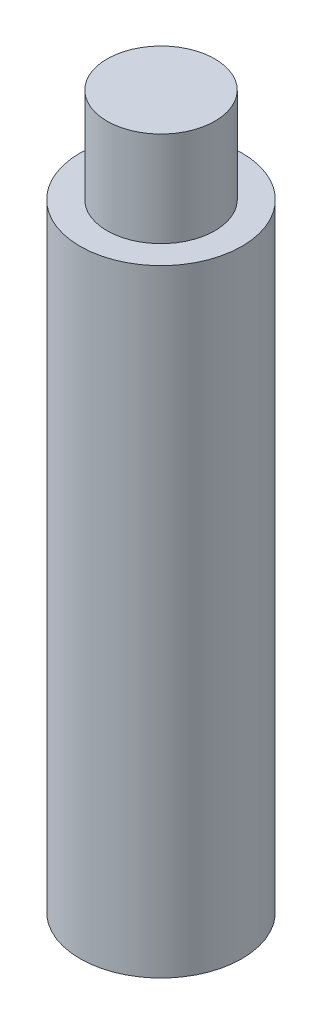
SolidWorks part; units mm, degrees
ref_plane "Front Plane" through (0, 0, 0) normal (0, 0, 1) x (1, 0, 0)
ref_plane "Top Plane" through (0, 0, 0) normal (0, 1, 0) x (1, 0, 0)
ref_plane "Right Plane" through (0, 0, 0) normal (1, 0, 0) x (0, 0, -1)
sketch "Sketch1" plane through (0, 0, 0) normal (0, 1, 0) x (1, 0, 0)
  circle A0 centre (0, 0) radius 9.525
  dimension "D1" = 19.05
extrude "Extrude1" add sketch "Sketch1" along normal blind 72.644
sketch "Sketch2" plane through (0, 0, 0) normal (0, -1, 0) x (1, 0, 0)
  circle A0 centre (0, 0) radius 2.9845
  dimension "D1" = 5.969
extrude "Cut-Extrude1" cut sketch "Sketch2" against normal blind 50.8
sketch "Sketch3" plane through (0, 72.644, 0) normal (0, 1, 0) x (-1, 0, 0)
  circle A0 centre (0, 0) radius 6.35
  dimension "D1" = 12.7
extrude "Extrude2" add sketch "Sketch3" along normal blind 11.176
